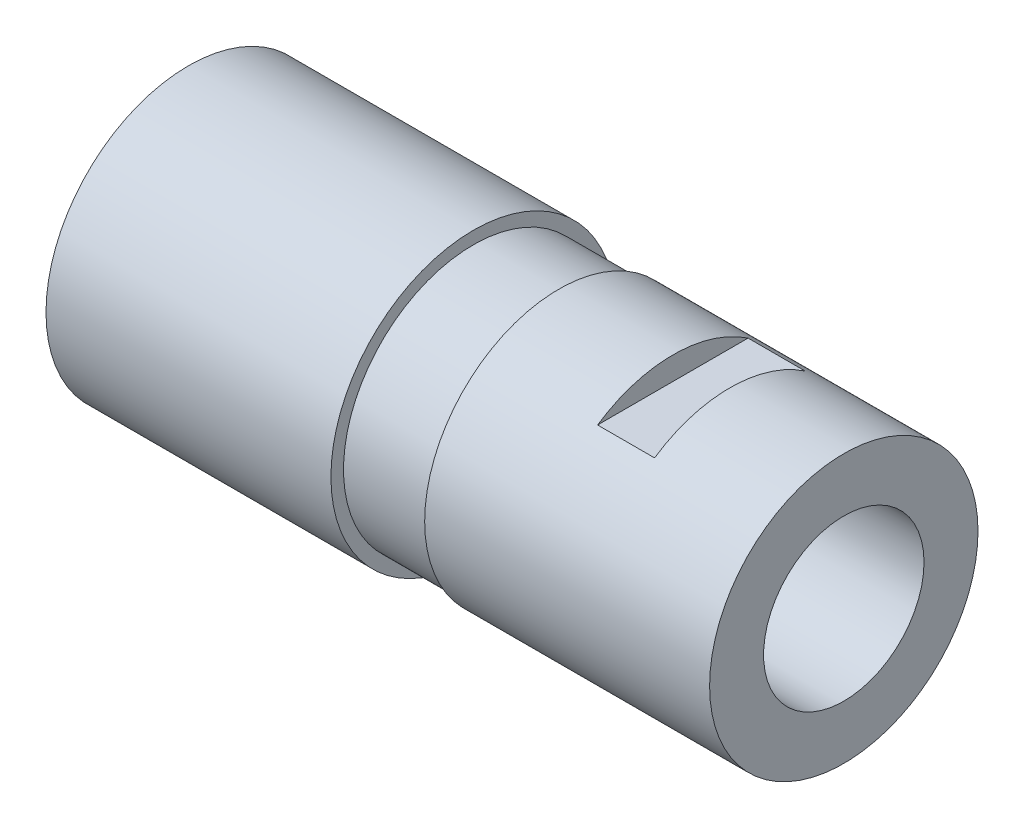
SolidWorks part; units mm, degrees
ref_plane "Front Plane" through (0, 0, 0) normal (0, 0, 1) x (1, 0, 0)
ref_plane "Top Plane" through (0, 0, 0) normal (0, 1, 0) x (1, 0, 0)
ref_plane "Right Plane" through (0, 0, 0) normal (1, 0, 0) x (0, 0, -1)
sketch "Sketch1" plane through (0, 0, 0) normal (0, 0, 1) x (1, 0, 0)
  line L0 (2.58, 0) -> (-4.9529, 0) construction
  line L1 (0, 3.5763) -> (0, 5.9817)
  line L2 (0, 5.9817) -> (-12.7, 5.9817)
  line L3 (0, 3.5763) -> (-11.1125, 3.5763)
  line L4 (-11.1125, 3.5763) -> (-11.1125, 3.175)
  line L5 (-11.1125, 3.175) -> (-29.21, 3.175)
  line L6 (-12.7, 5.9817) -> (-12.7, 5.7885)
  line L7 (-12.7, 5.7885) -> (-16.51, 5.7885)
  line L8 (-16.51, 5.7885) -> (-16.51, 6.35)
  line L9 (-16.51, 6.35) -> (-29.21, 6.35)
  line L10 (-29.21, 6.35) -> (-29.21, 3.175)
  dimension "D1" = 11.9634
  dimension "D2" = 7.1526
  dimension "D3" = 6.35
  dimension "D4" = 11.1125
  dimension "D5" = 3.81
  dimension "D6" = 11.5771
  dimension "D7" = 12.7
  dimension "D8" = 12.7
  dimension "D9" = 12.7
revolve "Revolve1" add sketch "Sketch1" angle 360 about L0
sketch "Sketch2" plane through (0, 0, 0) normal (0, 0, 1) x (1, 0, 0)
  line L0 (0, 5.9817) -> (-12.7, 5.9817) construction
  line L1 (-7.62, 5.9817) -> (-5.08, 5.9817)
  line L2 (-7.62, 5.9817) -> (-7.62, 4.953)
  line L3 (-7.62, 4.953) -> (-5.08, 4.953)
  line L4 (-5.08, 5.9817) -> (-5.08, 4.953)
  line L5 (-12.7, -5.9817) -> (0, -5.9817) construction
  line L6 (-7.62, -5.9817) -> (-5.08, -5.9817)
  line L7 (-7.62, -5.9817) -> (-7.62, -4.953)
  line L8 (-7.62, -4.953) -> (-5.08, -4.953)
  line L9 (-5.08, -5.9817) -> (-5.08, -4.953)
  line L10 (-31.9833, 0) -> (1.1412, 0) construction
  line L12 (-12.7, 5.9817) -> (-12.7, -5.9817) construction
  dimension "D1" = 7.62
  dimension "D2" = 2.54
  dimension "D3" = 9.906
extrude "Cut-Extrude1" cut sketch "Sketch2" against normal up to next and the other way up to next
